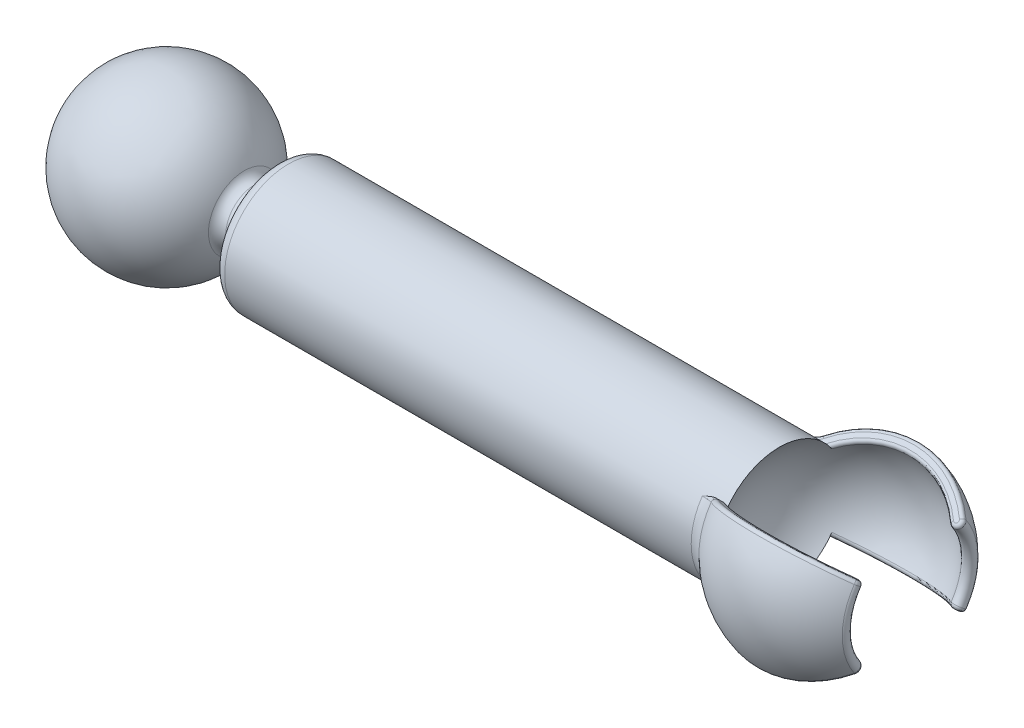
SolidWorks part; units mm, degrees
ref_plane "Front Plane" through (0, 0, 0) normal (0, 0, 1) x (1, 0, 0)
ref_plane "Top Plane" through (0, 0, 0) normal (0, 1, 0) x (1, 0, 0)
ref_plane "Right Plane" through (0, 0, 0) normal (1, 0, 0) x (0, 0, -1)
sketch "Sketch1" plane through (0, 0, 0) normal (0, 0, 1) x (1, 0, 0)
  line L0 (9.6419, 3.175) -> (10.795, 3.175)
  line L1 (12.065, 4.445) -> (12.065, 5.715)
  line L2 (13.335, 6.985) -> (67.0064, 6.985)
  line L3 (-9.3472, 0) -> (63.9572, 0)
  line L4 (0, 0) -> (-28.7058, 0) construction
  arc A0 (-9.3472, 0) -> (8.4886, 3.9133) centre (0, 0) cw
  arc A1 (63.9572, 0) -> (67.0064, 6.985) centre (73.4822, 0) cw
  arc A2 (12.065, 5.715) -> (13.335, 6.985) centre (13.335, 5.715) cw
  arc A3 (10.795, 3.175) -> (12.065, 4.445) centre (10.795, 4.445) ccw
  arc A4 (8.4886, 3.9133) -> (9.6419, 3.175) centre (9.6419, 4.445) ccw
  point P13 (12.065, 3.175)
  dimension "D1" = 9.3472
  dimension "D5" = 9.525
  dimension "D7" = 1.27
  dimension "D2" = 3.175
  dimension "D3" = 12.065
  dimension "D4" = 63.9572
  dimension "D6" = 6.985
revolve "Revolve1" add sketch "Sketch1" angle 360 about L4
sketch "Sketch2" plane through (0, 0, 0) normal (0, 1, 0) x (1, 0, 0)
  line L1 (13.335, -6.985) -> (67.0064, -6.985) construction
  line L2 (65.2517, -6.985) -> (67.0064, -6.985)
  line L3 (0, 0) -> (90.3767, 0) construction
  arc A1 (67.0064, 6.985) -> (67.0064, -6.985) centre (73.4822, 0) ccw construction
  arc A2 (67.0064, -6.985) -> (80.3991, -6.5484) centre (73.4822, 0) ccw
  arc A3 (65.2517, -6.985) -> (81.3214, -7.4216) centre (73.4822, 0) ccw
  arc A4 (80.3991, -6.5484) -> (81.3214, -7.4216) centre (80.8602, -6.985) cw
  dimension "D1" = 1.27
revolve "Revolve2" add sketch "Sketch2" angle 75 about L3
mirror "Mirror1" about plane through (0, 0, 0) normal (0, 0, 1) of "Revolve2"
fillet "Fillet1" radius 2.032 2 edges at (65.2517, 0, -6.985) (65.2517, 0, 6.985)
fillet "Fillet2" radius 0.381 16 edges at (65.1425, -4.3477, 5.6661) (73.5984, -6.5712, 8.5638) (65.1425, 4.3477, 5.6661) (65.1425, -4.3477, -5.6661) (65.1425, 4.3477, -5.6661) (73.7925, -5.7954, 7.5527) (81.2968, -3.9715, 5.1757) (73.5984, 6.5712, 8.5638) (73.7925, 5.7954, 7.5527) (81.2968, 3.9715, 5.1757) (73.5984, -6.5712, -8.5638) (73.7925, -5.7954, -7.5527) (81.2968, -3.9715, -5.1757) (73.5984, 6.5712, -8.5638) (73.7925, 5.7954, -7.5527) (81.2968, 3.9715, -5.1757)
